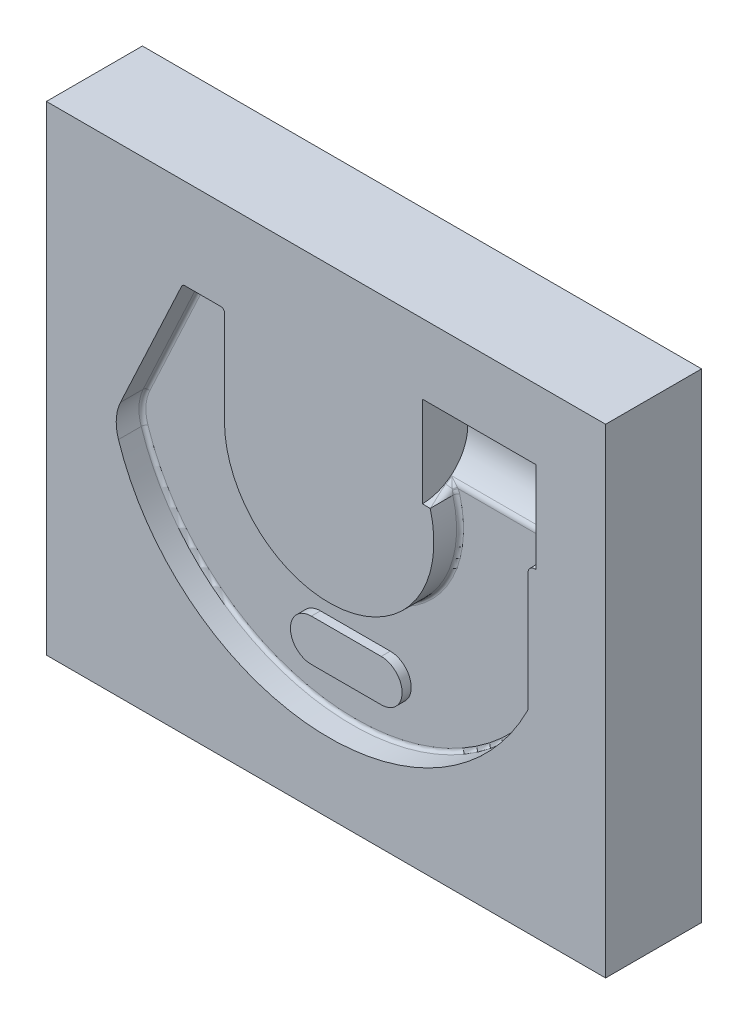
SolidWorks part; units mm, degrees
ref_plane "Plan de face" through (0, 0, 0) normal (0, 0, 1) x (1, 0, 0)
ref_plane "Plan de dessus" through (0, 0, 0) normal (0, 1, 0) x (1, 0, 0)
ref_plane "Plan de droite" through (0, 0, 0) normal (1, 0, 0) x (0, 0, -1)
body saved out of another part "Stock-Solution-1"
